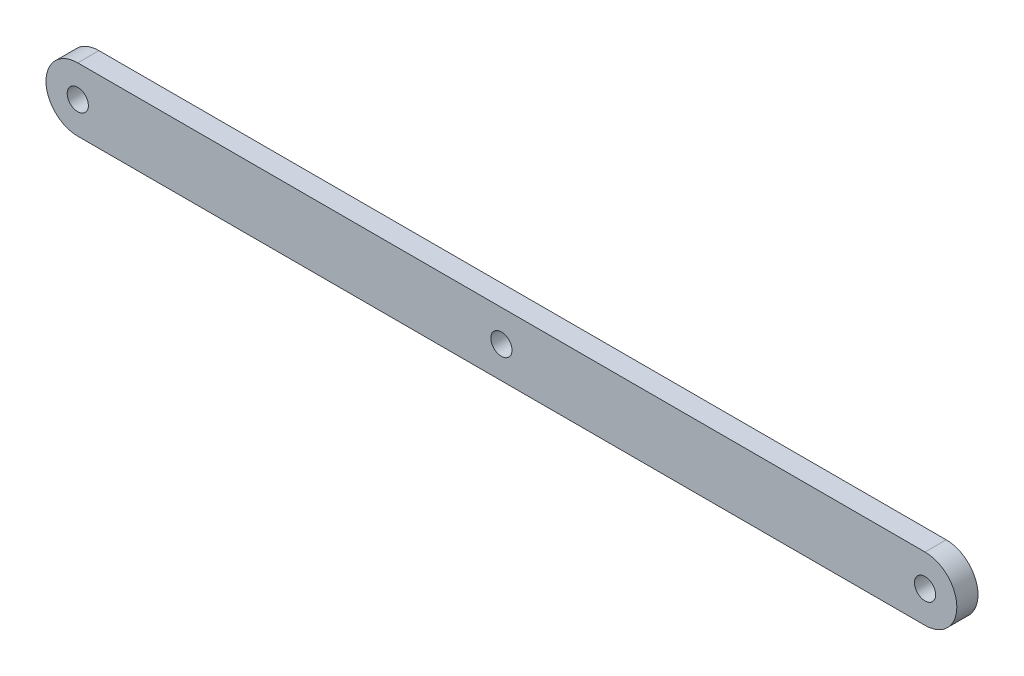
SolidWorks part; units mm, degrees
ref_plane "Front Plane" through (0, 0, 0) normal (0, 0, 1) x (1, 0, 0)
ref_plane "Top Plane" through (0, 0, 0) normal (0, 1, 0) x (1, 0, 0)
ref_plane "Right Plane" through (0, 0, 0) normal (1, 0, 0) x (0, 0, -1)
sketch "Sketch1" plane through (0, 0, 0) normal (0, 0, 1) x (1, 0, 0)
  line L1 (0, 0) -> (508, 0)
  line L3 (0, 38.1) -> (508, 38.1)
  arc A0 (0, 38.1) -> (0, 0) centre (0, 19.05) ccw
  arc A1 (508, 0) -> (508, 38.1) centre (508, 19.05) ccw
  dimension "D1" = 508
  dimension "D2" = 38.1
extrude "Extrude1" add sketch "Sketch1" along normal blind 12.7
ref_plane "Plane1" through (254, 0, 0) normal (1, 0, 0) x (0, 0, -1)
sketch "Sketch6" plane through (0, 0, 12.7) normal (0, 0, 1) x (1, 0, 0)
  circle A0 centre (0, 19.05) radius 6.35
  arc A1 (0, 38.1) -> (0, 0) centre (0, 19.05) ccw construction
  dimension "D1" = 12.7
extrude "Cut-Extrude4" cut sketch "Sketch6" against normal through all
mirror "Mirror1" about plane through (254, 0, 0) normal (1, 0, 0) of "Cut-Extrude4"
sketch "Sketch7" plane through (0, 0, 12.7) normal (0, 0, 1) x (1, 0, 0)
  line L14 (0, 0) -> (508, 0) construction
  circle A0 centre (254, 19.05) radius 6.35
  circle A1 centre (0, 19.05) radius 6.35 construction
  dimension "D1" = 12.7
  dimension "D2" = 254
  dimension "D3" = 19.05
extrude "Cut-Extrude5" cut sketch "Sketch7" against normal through all
